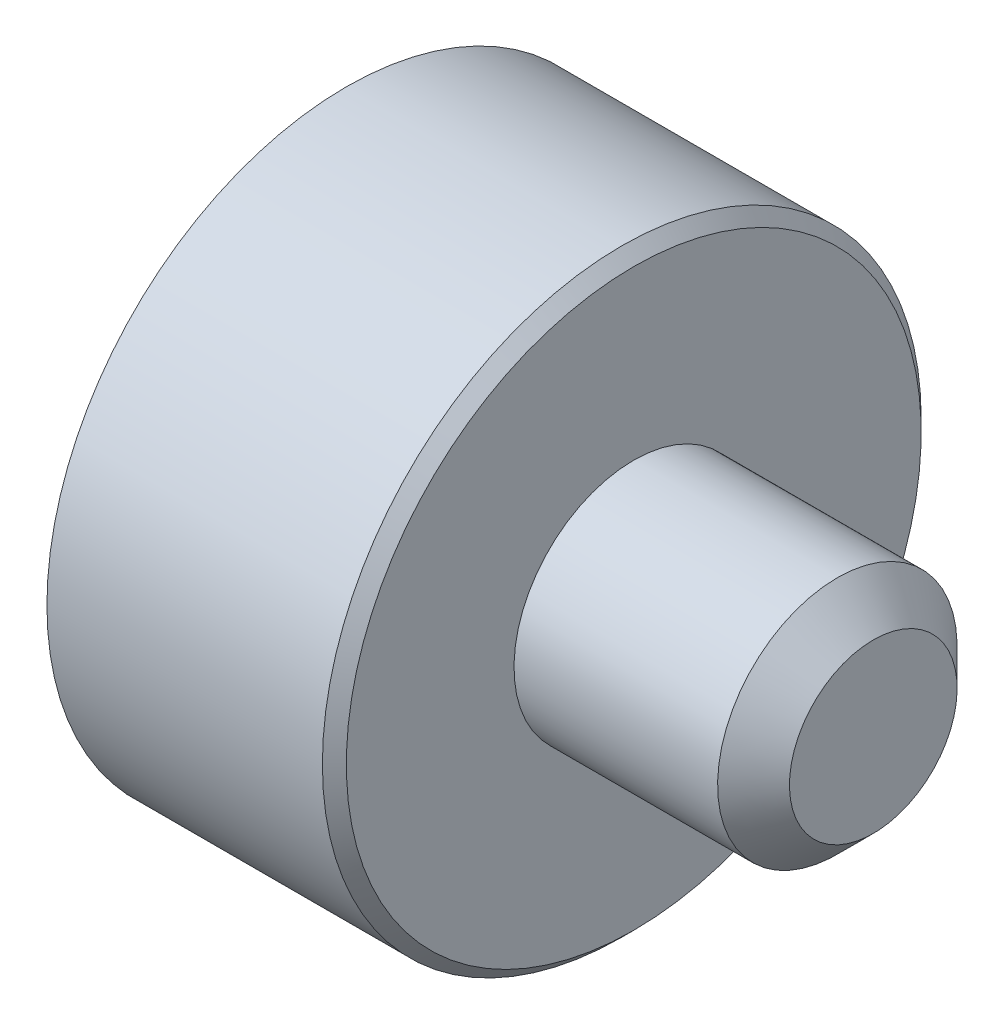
SolidWorks part; units mm, degrees
ref_plane "Спереди" through (0, 0, 0) normal (0, 0, 1) x (1, 0, 0)
ref_plane "Сверху" through (0, 0, 0) normal (0, 1, 0) x (1, 0, 0)
ref_plane "Справа" through (0, 0, 0) normal (1, 0, 0) x (0, 0, -1)
sketch "Эскиз1" plane through (0, 0, 0) normal (0, 0, 1) x (1, 0, 0)
  line L0 (0, 0) -> (0, 5)
  line L1 (0, 5) -> (5, 5)
  line L2 (5, 5) -> (5, 12.5)
  line L3 (5, 12.5) -> (16.5, 12.5)
  line L4 (27, 3.5) -> (25.5, 5)
  line L5 (17, 12) -> (17, 5)
  line L6 (17, 5) -> (25.5, 5)
  line L7 (17, 12) -> (16.5, 12.5)
  line L8 (27, 3.5) -> (27, 0)
  line L9 (27, 0) -> (0, 0)
  dimension "D1" = 27
  dimension "D2" = 12
  dimension "D3" = 5
  dimension "D4" = 5
  dimension "D5" = 12.5
  dimension "D6" = 45
  dimension "D7" = 45
  dimension "D8" = 1.5
  dimension "D9" = 0.5
revolve "Повернуть1" add sketch "Эскиз1" angle 360 about L9
